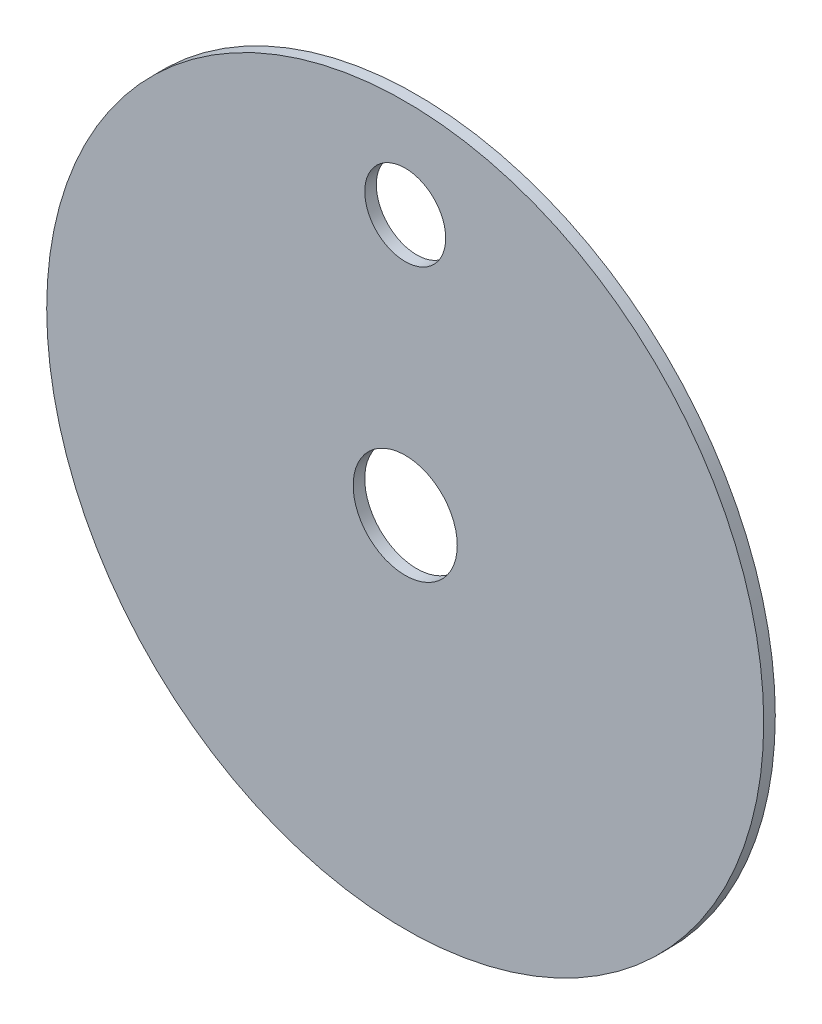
SolidWorks part; units mm, degrees
ref_plane "Plan de face" through (0, 0, 0) normal (0, 0, 1) x (1, 0, 0)
ref_plane "Plan de dessus" through (0, 0, 0) normal (0, 1, 0) x (1, 0, 0)
ref_plane "Plan de droite" through (0, 0, 0) normal (1, 0, 0) x (0, 0, -1)
ref_plane "Plan1" through (0, 0, -0.5) normal (0, 0, -1) x (-1, 0, 0)
sketch "Esquisse1" plane through (0, 0, -0.5) normal (0, 0, -1) x (-1, 0, 0)
  circle A0 centre (0, 0) radius 31
  circle A1 centre (0, 22.5) radius 3.5
  circle A2 centre (0, 0) radius 4.5
extrude "Boss.-Extru.1" add sketch "Esquisse1" against normal blind 1
